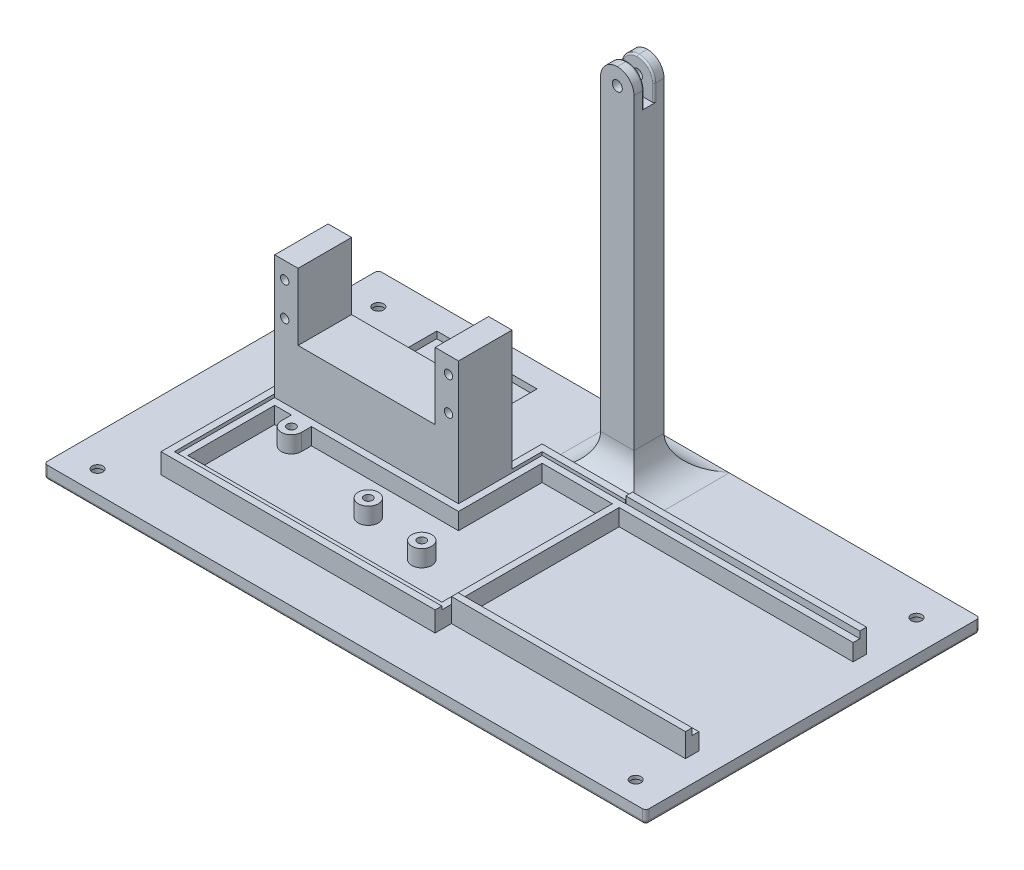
SolidWorks part; units mm, degrees
ref_plane "Ebene vorne" through (0, 0, 0) normal (0, 0, 1) x (1, 0, 0)
ref_plane "Ebene oben" through (0, 0, 0) normal (0, 1, 0) x (1, 0, 0)
ref_plane "Ebene rechts" through (0, 0, 0) normal (1, 0, 0) x (0, 0, -1)
sketch "Skizze1" plane through (0, 0, 0) normal (0, 1, 0) x (1, 0, 0)
  line L1 (-90, -50) -> (90, -50)
  line L2 (-90, -50) -> (-90, 50)
  line L3 (-90, 50) -> (90, 50)
  line L4 (90, -50) -> (90, 50)
  line L5 (-90, -50) -> (90, 50) construction
  line L6 (-90, 50) -> (90, -50) construction
  point P0 (0, 0)
  dimension "D1" = 100
  dimension "D2" = 180
extrude "Aufsatz-Linear austragen1" add sketch "Skizze1" along normal blind 4
sketch "Skizze2" plane through (0, 4, 0) normal (0, 1, 0) x (1, 0, 0)
  line L0 (0, 50) -> (0, -50) construction
  line L1 (90, 50) -> (-90, 50) construction
  line L2 (-90, -50) -> (90, -50) construction
  line L4 (-5, 31.5) -> (5, 31.5)
  line L5 (-5, 31.5) -> (-5, 40.5)
  line L6 (-5, 40.5) -> (5, 40.5)
  line L7 (5, 31.5) -> (5, 40.5)
  line L8 (-5, 31.5) -> (5, 40.5) construction
  line L9 (-5, 40.5) -> (5, 31.5) construction
  point P6 (0, 36)
  dimension "D1" = 9
  dimension "D2" = 14
  dimension "D3" = 10
extrude "Aufsatz-Linear austragen2" add sketch "Skizze2" along normal blind 107
sketch "Skizze3" plane through (0, 0, -31.5) normal (0, 0, 1) x (1, 0, 0)
  line L0 (-5, 111) -> (5, 101) construction
  line L1 (5, 111) -> (5, 4) construction
  line L2 (-5, 111) -> (5, 111) construction
  circle A0 centre (0, 106) radius 1.5
  dimension "D1" = 3
  dimension "D2" = 45
extrude "Schnitt-Linear austragen1" cut sketch "Skizze3" against normal blind 97
sketch "Skizze4" plane through (0, 111, 0) normal (0, 1, 0) x (1, 0, 0)
  line L0 (-5, 40.5) -> (5, 31.5) construction
  line L1 (5, 31.5) -> (5, 40.5) construction
  line L2 (-5, 37.525) -> (5, 37.525)
  line L3 (-5, 37.525) -> (-5, 34.475)
  line L4 (-5, 34.475) -> (5, 34.475)
  line L5 (5, 37.525) -> (5, 34.475)
  line L6 (-5, 37.525) -> (5, 34.475) construction
  line L7 (-5, 34.475) -> (5, 37.525) construction
  point P4 (0, 36)
  dimension "D1" = 3.05
extrude "Schnitt-Linear austragen2" cut sketch "Skizze4" against normal blind 10
fillet "Verrundung1" radius 5 4 edges at (-5, 111, -32.9875) (-5, 111, -39.0125) (5, 111, -39.0125) (5, 111, -32.9875)
sketch "Skizze7" plane through (0, 4, 0) normal (0, 1, 0) x (1, 0, 0)
  line L0 (-50, 14.5) -> (-50, -3.5) construction
  line L1 (-67.5, 14.5) -> (-12.5, 14.5)
  line L2 (-67.5, 14.5) -> (-67.5, -3.5)
  line L3 (-67.5, -3.5) -> (-12.5, -3.5)
  line L4 (-12.5, 14.5) -> (-12.5, -3.5)
  line L5 (-67.5, 14.5) -> (-12.5, -3.5) construction
  line L6 (-67.5, -3.5) -> (-12.5, 14.5) construction
  line L7 (90, 50) -> (-90, 50) construction
  point P0 (-40, 5.5)
  dimension "D1" = 55
  dimension "D2" = 18
  dimension "D3" = 17.5
  dimension "D4" = 50
  dimension "D5" = 35.5
extrude "Aufsatz-Linear austragen4" add sketch "Skizze7" along normal blind 42
sketch "Skizze8" plane through (0, 0, 3.5) normal (0, 0, 1) x (1, 0, 0)
  line L0 (-67.5, 46) -> (-12.5, 46) construction
  line L1 (-60.5, 46) -> (-19.5, 46)
  line L2 (-60.5, 46) -> (-60.5, 26)
  line L3 (-60.5, 26) -> (-19.5, 26)
  line L4 (-19.5, 46) -> (-19.5, 26)
  line L5 (-67.5, 6.9678) -> (-12.5, 6.9678) construction
  line L6 (-67.5, 46) -> (-67.5, 4) construction
  line L7 (-12.5, 46) -> (-12.5, 4) construction
  line L8 (-60.5, 36) -> (-19.5, 36) construction
  point P12 (-40, 46)
  point P13 (-40, 6.9678)
  dimension "D1" = 41
  dimension "D2" = 20
extrude "Schnitt-Linear austragen4" cut sketch "Skizze8" against normal blind 37
sketch "Skizze9" plane through (0, 0, -14.5) normal (0, 0, -1) x (-1, 0, 0)
  line L0 (12.5, 46) -> (67.5, 46) construction
  line L1 (40, 46) -> (40, 26) construction
  line L2 (60.5, 26) -> (19.5, 26) construction
  line L3 (40, 26) -> (12.5, 26) construction
  line L4 (12.5, 46) -> (12.5, 4) construction
  line L5 (40, 26) -> (67.5, 26) construction
  line L6 (67.5, 46) -> (67.5, 4) construction
  circle A0 centre (15.5, 41) radius 1.25
  circle A1 centre (15.5, 31) radius 1.25
  circle A2 centre (64.5, 41) radius 1.25
  circle A3 centre (64.5, 31) radius 1.25
  dimension "D1" = 2.5
  dimension "D2" = 2.5
  dimension "D3" = 2.5
  dimension "D4" = 2.5
  dimension "D5" = 49
  dimension "D6" = 10
  dimension "D7" = 24.5
  dimension "D8" = 5
extrude "Schnitt-Linear austragen5" cut sketch "Skizze9" against normal blind 37
sketch "Skizze10" plane through (0, 4, 0) normal (0, 1, 0) x (1, 0, 0)
  line L0 (90, 50) -> (-90, 50) construction
  line L1 (-65.5, 43) -> (-35.5, 43)
  line L2 (-65.5, 43) -> (-65.5, 29)
  line L3 (-65.5, 29) -> (-35.5, 29)
  line L4 (-35.5, 43) -> (-35.5, 29)
  line L5 (-50.5, 43) -> (-50.5, 29) construction
  line L6 (-90, 50) -> (-90, -50) construction
  dimension "D1" = 7
  dimension "D2" = 14
  dimension "D3" = 39.5
  dimension "D4" = 30
extrude "Schnitt-Linear austragen6" cut sketch "Skizze10" against normal blind 2
sketch "Skizze11" plane through (0, 4, 0) normal (0, 1, 0) x (1, 0, 0)
  line L0 (-90, -50) -> (90, -50) construction
  line L1 (-80.5, -43.5) -> (80.5, -43.5) construction
  line L2 (0, -50) -> (0, 50) construction
  line L3 (90, 50) -> (-90, 50) construction
  circle A0 centre (-80.5, -43.5) radius 1.6
  circle A1 centre (80.5, -43.5) radius 1.6
  circle A2 centre (-80.5, 40.5) radius 1.6
  circle A3 centre (80.5, 40.5) radius 1.6
  point P10 (0, -43.5)
  dimension "D1" = 6.5
  dimension "D3" = 3.2
  dimension "D4" = 3.2
  dimension "D5" = 84
  dimension "D6" = 3.2
  dimension "D7" = 3.2
  dimension "D2" = 161
extrude "Schnitt-Linear austragen7" cut sketch "Skizze11" against normal blind 10
fillet "Verrundung2" radius 10 4 edges at (-5, 4, -36) (0, 4, -40.5) (5, 4, -36) (0, 4, -31.5)
sketch "Skizze12" plane through (0, 0, 0) normal (0, -1, 0) x (1, 0, 0)
  circle A0 centre (-80.5, 43.5) radius 3
  circle A1 centre (80.5, 43.5) radius 3
  circle A2 centre (80.5, -40.5) radius 3
  circle A3 centre (-80.5, -40.5) radius 3
  dimension "D1" = 6
  dimension "D2" = 6
  dimension "D3" = 6
  dimension "D4" = 6
extrude "Schnitt-Linear austragen8" cut sketch "Skizze12" against normal blind 3
fillet "Verrundung4" radius 1 4 edges at (0, 0, 50) (90, 0, 0) (-90, 0, 0) (0, 0, -50)
fillet "Verrundung5" radius 1 8 edges at (89.7071, 0.2929, 49.7071) (89.7071, 0.2929, -49.7071) (-89.7071, 0.2929, -49.7071) (-89.7071, 0.2929, 49.7071) (90, 2.5, 50) (90, 2.5, -50) (-90, 2.5, -50) (-90, 2.5, 50)
sketch "Skizze13" plane through (0, 4, 0) normal (0, 1, 0) x (1, 0, 0)
  line L0 (-89, -50) -> (89, -50) construction
  line L1 (-90, 49) -> (-90, -49) construction
  line L2 (-12.5, -3.5) -> (-67.5, -3.5) construction
  line L3 (-12.5, -3.5) -> (-12.5, 21.5) construction
  line L4 (-12.5, 21.5) -> (12.5, 21.5) construction
  line L5 (12.5, 21.5) -> (12.5, -33.5) construction
  line L6 (12.5, -33.5) -> (-67.5, -33.5) construction
  line L7 (-67.5, -33.5) -> (-67.5, -3.5) construction
  line L8 (-67.5, -3.5) -> (-67.5, -1.5)
  line L9 (-67.5, 14.5) -> (-67.5, -3.5) construction
  line L10 (-67.5, -1.5) -> (-69.5, -1.5)
  line L11 (-69.5, -1.5) -> (-69.5, -35.5)
  line L12 (-69.5, -35.5) -> (12.5, -35.5)
  line L13 (12.5, -35.5) -> (12.5, 23.5)
  line L14 (12.5, 23.5) -> (-14.5, 23.5)
  line L15 (-14.5, 23.5) -> (-14.5, 14.5)
  line L16 (-14.5, 14.5) -> (-12.5, 14.5)
  line L17 (-12.5, 14.5) -> (-12.5, -3.5)
  line L18 (-12.5, -3.5) -> (-67.5, -3.5)
  line L19 (-65.5, -5.5) -> (-65.5, -31.5)
  line L21 (-65.5, -31.5) -> (10.5, -31.5)
  line L22 (10.5, -31.5) -> (10.5, 19.5)
  line L23 (10.5, 19.5) -> (-10.5, 19.5)
  line L24 (-10.5, 19.5) -> (-10.5, -5.5)
  line L25 (-10.5, -5.5) -> (-65.5, -5.5)
  circle A0 centre (-8.5, -18.5) radius 1.25
  circle A1 centre (-27.5, -15.5) radius 1.25
  circle A2 centre (-57.5, -8.5) radius 1.25
  dimension "D2" = 81.5
  dimension "D3" = 34.5
  dimension "D4" = 2.5
  dimension "D5" = 62.5
  dimension "D6" = 2.5
  dimension "D8" = 32.5
  dimension "D9" = 2.5
  dimension "D1" = 31.5
  dimension "D7" = 41.5
  dimension "D10" = 25
  dimension "D11" = 25
  dimension "D12" = 55
  dimension "D13" = 55
  dimension "D14" = 2
  dimension "D15" = 2
  dimension "D16" = 2
  dimension "D17" = 2
  dimension "D18" = 2
  dimension "D19" = 2
  dimension "D20" = 2
  dimension "D21" = 2
  dimension "D22" = 2
  dimension "D23" = 2
  dimension "D24" = 2
extrude "Aufsatz-Linear austragen5" add sketch "Skizze13" along normal blind 5 contours L25 L24 L15 L10 L11 L12 L13 L22 L21 L19 M24 M47 M44 M45 M46 | L24 L23 L22 L13 L14 L15 M24
sketch "Skizze14" plane through (0, 9, 0) normal (0, 1, 0) x (1, 0, 0)
  line L0 (-67.5, -1.5) -> (-67.5, -33.5)
  line L1 (-67.5, -33.5) -> (12.5, -33.5)
  line L2 (12.5, -33.5) -> (12.5, -35.5)
  line L3 (12.5, -35.5) -> (-69.5, -35.5)
  line L4 (-69.5, -35.5) -> (-69.5, -1.5)
  line L5 (-69.5, -1.5) -> (-67.5, -1.5)
  line L6 (-12.5, 14.5) -> (-14.5, 14.5)
  line L7 (-14.5, 14.5) -> (-14.5, 23.5)
  line L8 (-14.5, 23.5) -> (12.5, 23.5)
  line L9 (12.5, 23.5) -> (12.5, 21.5)
  line L10 (-12.5, 21.5) -> (12.5, 21.5) construction
  line L11 (12.5, 21.5) -> (-12.5, 21.5)
  line L12 (-12.5, 21.5) -> (-12.5, 14.5)
extrude "Aufsatz-Linear austragen6" add sketch "Skizze14" along normal blind 1
sketch "Skizze15" plane through (0, 4, 0) normal (0, 1, 0) x (1, 0, 0)
  line L0 (-60.5, -8.5) -> (-60.5, -5.5)
  line L1 (-10.5, -5.5) -> (-65.5, -5.5) construction
  line L2 (-60.5, -5.5) -> (-54.5, -5.5)
  line L3 (-54.5, -5.5) -> (-54.5, -8.5)
  circle A0 centre (-27.5, -15.5) radius 1.25
  circle A1 centre (-27.5, -15.5) radius 3
  circle A2 centre (-8.5, -18.5) radius 1.25
  circle A3 centre (-8.5, -18.5) radius 3
  circle A4 centre (-57.5, -8.5) radius 1.25
  arc A5 (-60.5, -8.5) -> (-54.5, -8.5) centre (-57.5, -8.5) ccw
  dimension "D1" = 2.5
  dimension "D2" = 6
  dimension "D3" = 2.5
  dimension "D4" = 6
  dimension "D5" = 2.5
  dimension "D6" = 6
extrude "Aufsatz-Linear austragen8" add sketch "Skizze15" along normal blind 5
sketch "Skizze16" plane through (0, 4, 0) normal (0, 1, 0) x (1, 0, 0)
  line L0 (12.5, -35.5) -> (12.5, 21.5) construction
  line L1 (12.5, -28.6) -> (82.5, -28.6) construction
  line L2 (12.5, -28.6) -> (12.5, 21.56) construction
  line L3 (12.5, 21.56) -> (82.5, 21.56) construction
  line L4 (82.5, -28.6) -> (82.5, 21.56) construction
  line L5 (-89, -50) -> (89, -50) construction
  line L6 (12.5, 19.56) -> (12.5, 23.56)
  line L7 (12.5, 23.56) -> (82.5, 23.56)
  line L8 (82.5, 23.56) -> (82.5, 19.56)
  line L9 (82.5, 19.56) -> (12.5, 19.56)
  line L14 (12.5, -26.6) -> (82.5, -26.6)
  line L15 (82.5, -26.6) -> (82.5, -30.6)
  line L16 (82.5, -30.6) -> (12.5, -30.6)
  line L17 (12.5, -30.6) -> (12.5, -26.6)
  dimension "D1" = 21.4
  dimension "D2" = 50.16
  dimension "D3" = 70
  dimension "D4" = 4
  dimension "D5" = 2
  dimension "D6" = 2
  dimension "D7" = 4
extrude "Aufsatz-Linear austragen9" add sketch "Skizze16" along normal blind 5
sketch "Skizze17" plane through (0, 9, 0) normal (0, 1, 0) x (1, 0, 0)
  line L1 (12.5, 21.56) -> (82.5, 21.56)
  line L2 (12.5, 21.56) -> (12.5, 23.56)
  line L3 (12.5, 23.56) -> (82.5, 23.56)
  line L4 (82.5, 21.56) -> (82.5, 23.56)
  line L5 (12.5, -30.6) -> (82.5, -30.6)
  line L6 (12.5, -30.6) -> (12.5, -28.6)
  line L7 (12.5, -28.6) -> (82.5, -28.6)
  line L8 (82.5, -30.6) -> (82.5, -28.6)
extrude "Aufsatz-Linear austragen10" add sketch "Skizze17" along normal blind 2
fillet "Verrundung6" radius 0.5 8 edges at (5, 103.5, -34.475) (3.5355, 109.5355, -34.475) (-3.5355, 109.5355, -34.475) (5, 103.5, -37.525) (3.5355, 109.5355, -37.525) (-3.5355, 109.5355, -37.525) (-5, 103.5, -34.475) (-5, 103.5, -37.525)
sketch "Skizze18" plane through (0, 0, -14.5) normal (0, 0, -1) x (-1, 0, 0)
  line L0 (14.5, 4) -> (14.5, 10)
  line L1 (14.5, 10) -> (12.5, 10)
  line L2 (12.5, 10) -> (12.5, 46)
  line L3 (12.5, 46) -> (67.5, 46)
  line L4 (67.5, 46) -> (67.5, 4)
  line L5 (67.5, 4) -> (14.5, 4)
extrude "Schnitt-Linear austragen9" cut sketch "Skizze18" against normal blind 2
